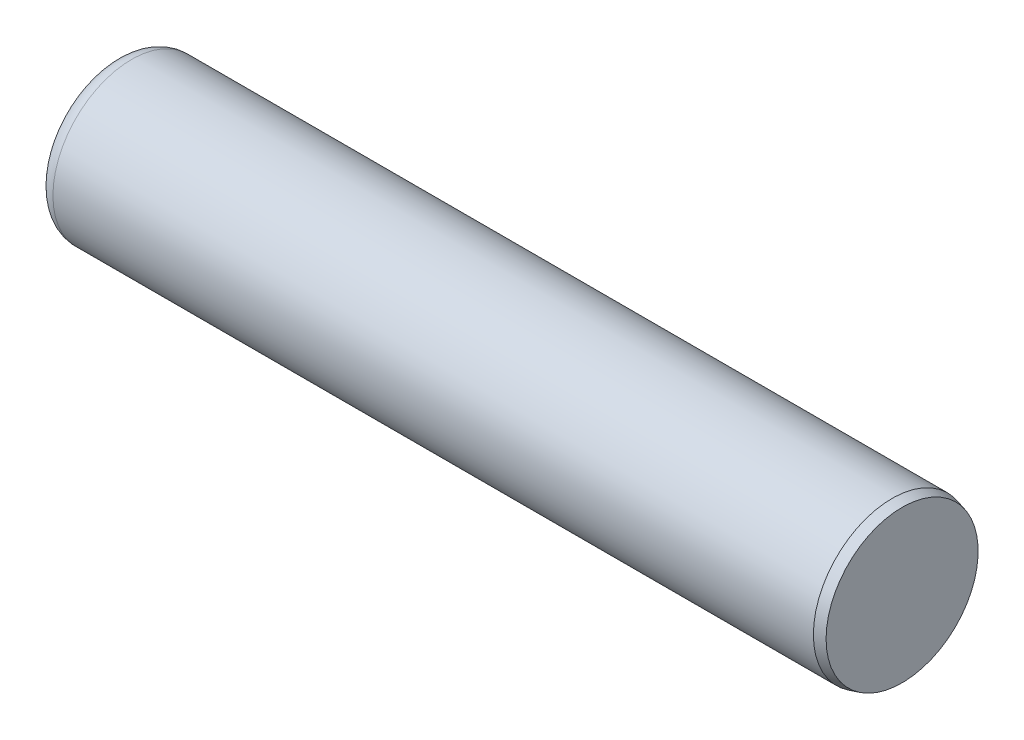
SolidWorks part; units mm, degrees
ref_plane "Plane1" through (0, 0, 0) normal (0, 0, 1) x (1, 0, 0)
ref_plane "Plane2" through (0, 0, 0) normal (0, 1, 0) x (1, 0, 0)
ref_plane "Plane3" through (0, 0, 0) normal (1, 0, 0) x (0, 0, -1)
revolve "Base-Revolve" add sketch "Sketch1" angle 360 about L1
sketch "Sketch1" plane through (0, 0, 0) normal (0, 0, 1) x (1, 0, 0)
  line L1 (-6.35, 0) -> (107.95, 0) construction
  line L2 (0, 0) -> (15, 0)
  line L3 (15, 0) -> (15, 1.4488)
  line L4 (15, 1.4488) -> (14.8089, 1.5)
  line L5 (14.8089, 1.5) -> (0.3185, 1.5)
  line L6 (0, 1.1815) -> (0, 0)
  arc A0 (0.3185, 1.5) -> (0, 1.1815) centre (0.3185, 1.1815) ccw
  dimension "D4" = 0.3185
  dimension "D2" = 0.1911
  dimension "D3" = 15
  dimension "Diameter" = 3
  dimension "Length" = 15
